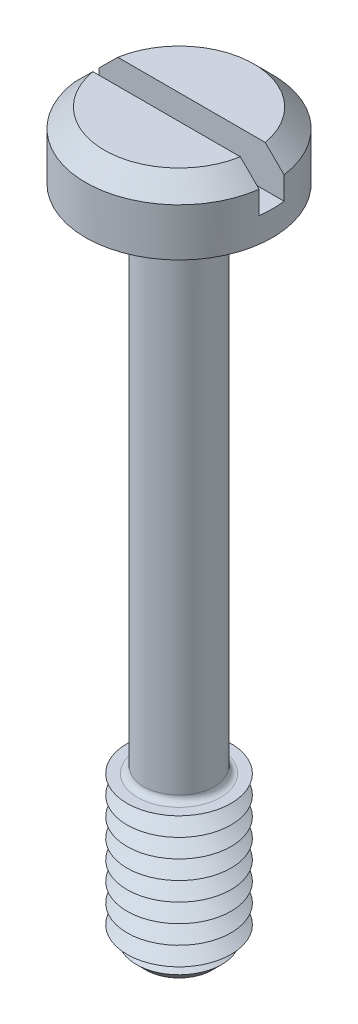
SolidWorks part; units mm, degrees
ref_plane "Front Plane" through (0, 0, 0) normal (0, 0, 1) x (1, 0, 0)
ref_plane "Top Plane" through (0, 0, 0) normal (0, 1, 0) x (1, 0, 0)
ref_plane "Right Plane" through (0, 0, 0) normal (1, 0, 0) x (0, 0, -1)
sketch "Sketch1" plane through (0, 0, 0) normal (0, 1, 0) x (1, 0, 0)
  circle A0 centre (0, 0) radius 2.25
  dimension "D1" = 4.5
extrude "Boss-Extrude1" add sketch "Sketch1" along normal blind 1.6
sketch "Sketch2" plane through (0, 0, 0) normal (0, -1, 0) x (1, 0, 0)
  circle A0 centre (0, 0) radius 0.85
  dimension "D1" = 1.7
extrude "Boss-Extrude2" add sketch "Sketch2" along normal blind 16
sketch "Sketch3" plane through (0, -16, 0) normal (0, -1, 0) x (1, 0, 0)
  circle A0 centre (0, 0) radius 1.25
  dimension "D1" = 2.5
extrude "Boss-Extrude3" add sketch "Sketch3" against normal blind 3.7
chamfer "Chamfer1" distance 0.45 angle 45 1 edges at (0, -16, -1.25)
sketch "Sketch4" plane through (0, 0, 0) normal (1, 0, 0) x (0, 0, -1)
  line L0 (0, -6.5871) -> (0, -12.0372) construction
sketch "Sketch5" plane through (0, 0, 0) normal (1, 0, 0) x (0, 0, -1)
  line L0 (-1.25, -12.3) -> (-0.8603, -12.525)
  line L1 (-0.8603, -12.525) -> (-1.25, -12.75)
  line L2 (-1.25, -12.3) -> (-1.25, -15.55) construction
  line L3 (-1.25, -12.75) -> (-1.25, -12.3)
  dimension "D1" = 0.45
revolve "Cut-Revolve1" cut sketch "Sketch5" angle 360 about L0
pattern_linear "LPattern1" count 8 spacing 0.45 along (0, -1, 0) of "Cut-Revolve1"
fillet "Fillet1" radius 0.15 2 edges at (0, -12.3, -0.85) (0, 0, -0.85)
chamfer "Chamfer2" distance 0.45 angle 45 1 edges at (0, 1.6, 2.25)
sketch "Sketch6" plane through (0, 1.6, 0) normal (0, 1, 0) x (1, 0, 0)
  line L1 (2.25, -0.3) -> (-2.25, -0.3)
  line L2 (2.25, -0.3) -> (2.25, 0.3)
  line L3 (2.25, 0.3) -> (-2.25, 0.3)
  line L4 (-2.25, -0.3) -> (-2.25, 0.3)
  line L5 (2.25, -0.3) -> (-2.25, 0.3) construction
  line L6 (2.25, 0.3) -> (-2.25, -0.3) construction
  circle A0 centre (0, 0) radius 2.25 construction
  point P0 (0, 0)
  dimension "D1" = 0.6
extrude "Cut-Extrude1" cut sketch "Sketch6" against normal blind 1
